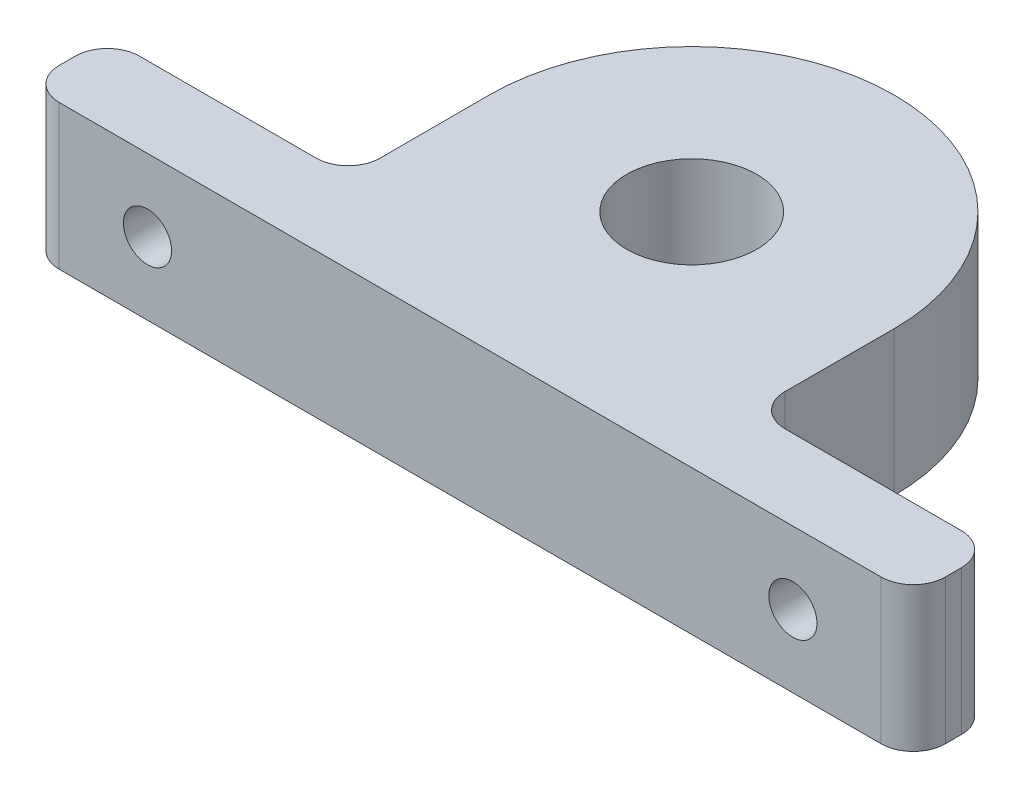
SolidWorks part; units mm, degrees
ref_plane "Front Plane" through (0, 0, 0) normal (0, 0, 1) x (1, 0, 0)
ref_plane "Top Plane" through (0, 0, 0) normal (0, 1, 0) x (1, 0, 0)
ref_plane "Right Plane" through (0, 0, 0) normal (1, 0, 0) x (0, 0, -1)
sketch "Sketch1" plane through (0, 0, 0) normal (0, 1, 0) x (1, 0, 0)
  line L0 (-27.6, -13.8) -> (27.6, -13.8)
  line L1 (0, 0) -> (0, 14.3442) construction
  line L2 (27.6, -13.8) -> (27.6, -8.8)
  line L3 (27.6, -8.8) -> (12.6, -8.8)
  line L4 (12.6105, 0) -> (12.6, -8.8)
  line L5 (-12.6105, 0) -> (-12.6, -8.8)
  line L6 (-27.6, -13.8) -> (-27.6, -8.8)
  line L7 (-27.6, -8.8) -> (-12.6, -8.8)
  circle A0 centre (0, 0) radius 4.05
  arc A1 (12.6105, 0) -> (-12.6105, 0) centre (0, 0) ccw
  point P6 (0, -13.8)
  dimension "D1" = 8.1
  dimension "D2" = 55.2
  dimension "D3" = 13.8
  dimension "D4" = 5
  dimension "D5" = 15
extrude "Boss-Extrude1" add sketch "Sketch1" along normal blind 9 contours L1 L0 L2 L3 L4 A1 A0 | L0 L1 A0 A1 L5 L7 L6
fillet "Fillet1" radius 2 6 edges at (27.6, 4.5, 13.8) (-27.6, 4.5, 13.8) (-27.6, 4.5, 8.8) (27.6, 4.5, 8.8) (12.6, 4.5, 8.8) (-12.6, 4.5, 8.8)
sketch "Sketch2" plane through (0, 0, 8.8) normal (0, 0, -1) x (-1, 0, 0)
  line L0 (25.6, 0) -> (14.6024, 9) construction
  line L1 (14.6024, 9) -> (12.6024, 9) construction
  line L2 (14.6024, 9) -> (14.6024, 0) construction
  line L3 (25.6, 9) -> (14.6024, 0) construction
  line L4 (0, -0.3588) -> (0, -11.9609) construction
  circle A0 centre (20.1012, 4.5) radius 1.5
  circle A1 centre (-20.1012, 4.5) radius 1.5
  dimension "D1" = 3
extrude "Cut-Extrude1" cut sketch "Sketch2" against normal blind 10
